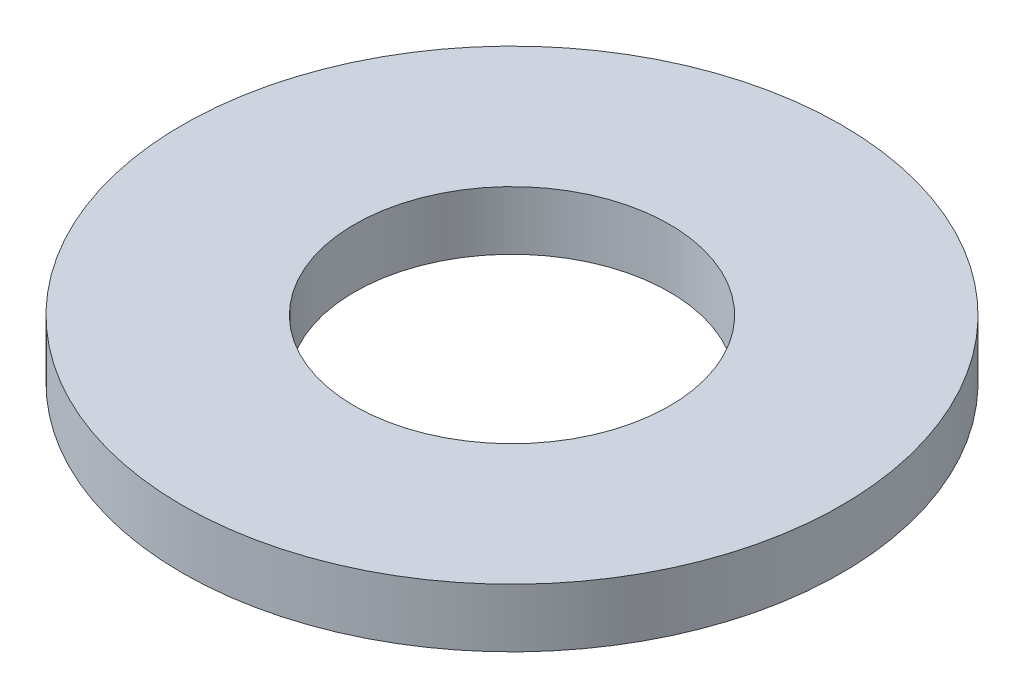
SolidWorks part; units mm, degrees
ref_plane "Front" through (0, 0, 0) normal (0, 0, 1) x (1, 0, 0)
ref_plane "Top" through (0, 0, 0) normal (0, 1, 0) x (1, 0, 0)
ref_plane "Right" through (0, 0, 0) normal (1, 0, 0) x (0, 0, -1)
sketch "Sketch1" plane through (0, 0, 0) normal (0, 1, 0) x (1, 0, 0)
  circle A0 centre (0, 0) radius 2.15
  circle A1 centre (0, 0) radius 4.5
extrude "Extrude1" add sketch "Sketch1" along normal blind 0.8
